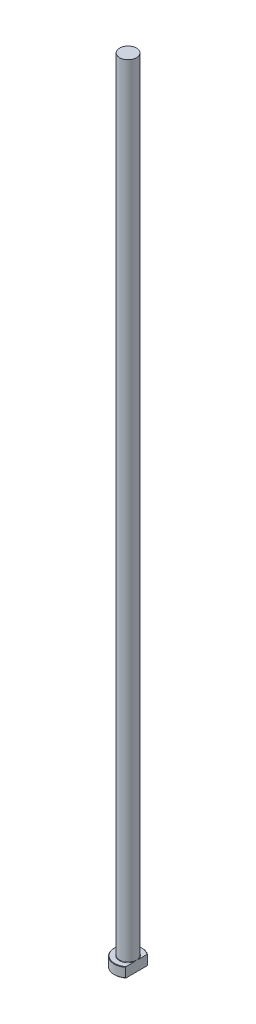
SolidWorks part; units mm, degrees
ref_plane "Front Plane" through (0, 0, 0) normal (0, 0, 1) x (1, 0, 0)
ref_plane "Top Plane" through (0, 0, 0) normal (0, 1, 0) x (1, 0, 0)
ref_plane "Right Plane" through (0, 0, 0) normal (1, 0, 0) x (0, 0, -1)
sketch "Sketch1" plane through (0, 0, 0) normal (0, 0, 1) x (1, 0, 0)
  line L0 (0, 259.9588) -> (0, -15.1925) construction
  line L1 (0, 0) -> (-7, 0)
  line L2 (-7, 0) -> (-7, 5)
  line L3 (-7, 5) -> (-4.25, 5)
  line L4 (-4.25, 5) -> (-4.25, 400)
  line L5 (-4.25, 400) -> (0, 400)
  line L6 (0, 400) -> (0, 0)
  dimension "L" = 400
  dimension "H" = 14
  dimension "T" = 5
  dimension "D" = 8.5
revolve "Revolve1" add sketch "Sketch1" angle 360 about L0
chamfer "Chamfer1" distance 0.2 angle 45 2 edges at (0, 5, 7) (0, 0, 7)
fillet "Fillet1" radius 0.2 1 edges at (0, 5, 4.25)
sketch "Sketch2" plane through (0, 0, 0) normal (0, 1, 0) x (1, 0, 0)
  line L0 (4.25, 5.5621) -> (4.25, -5.5621)
  circle A0 centre (0, 0) radius 7 construction
  arc A1 (4.25, -5.5621) -> (4.25, 5.5621) centre (0, 0) ccw
  circle A2 centre (0, 0) radius 4.25 construction
extrude "KEY" cut sketch "Sketch2" along normal through all
